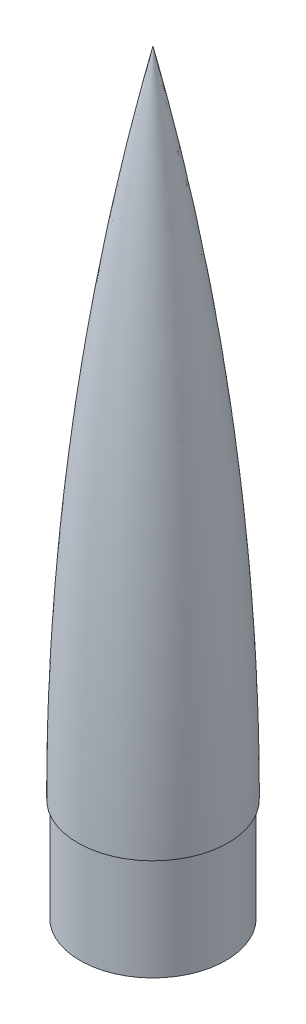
SolidWorks part; units mm, degrees
ref_plane "Front Plane" through (0, 0, 0) normal (0, 0, 1) x (1, 0, 0)
ref_plane "Top Plane" through (0, 0, 0) normal (0, 1, 0) x (1, 0, 0)
ref_plane "Right Plane" through (0, 0, 0) normal (1, 0, 0) x (0, 0, -1)
sketch "Sketch1" plane through (0, 0, 0) normal (0, 0, 1) x (1, 0, 0)
  line L0 (0, 0) -> (-26.9875, 0)
  line L1 (-26.9875, 38.1) -> (-26.9875, 0)
  line L2 (-26.9875, 38.1) -> (-27.813, 38.1)
  line L3 (0, 279.4) -> (0, 0) construction
  line L4 (0, 0) -> (0, 279.4)
  arc A0 (-27.813, 38.1) -> (0, 279.4) centre (1032.8287, 38.1) cw
  dimension "D1" = 26.9875
  dimension "D2" = 38.1
  dimension "D3" = 0.8255
  dimension "D4" = 241.3
revolve "Revolve1" add sketch "Sketch1" angle 360 about L3
shell "Shell1" thickness 1.5875
